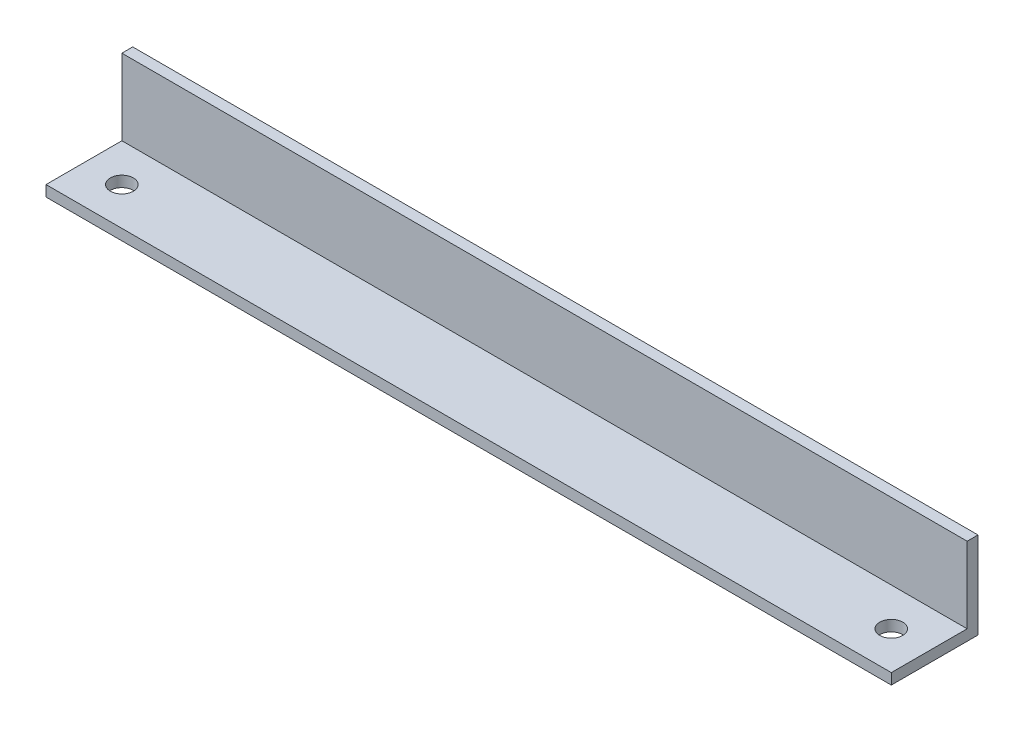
SolidWorks part; units mm, degrees
ref_plane "Front Plane" through (0, 0, 0) normal (0, 0, 1) x (1, 0, 0)
ref_plane "Top Plane" through (0, 0, 0) normal (0, 1, 0) x (1, 0, 0)
ref_plane "Right Plane" through (0, 0, 0) normal (1, 0, 0) x (0, 0, -1)
sketch "Sketch1" plane through (0, 0, 0) normal (0, 1, 0) x (1, 0, 0)
  line L1 (-123.825, 12.7) -> (123.825, 12.7)
  line L2 (-123.825, 12.7) -> (-123.825, -12.7)
  line L3 (-123.825, -12.7) -> (123.825, -12.7)
  line L4 (123.825, 12.7) -> (123.825, -12.7)
  line L5 (-123.825, 12.7) -> (123.825, -12.7) construction
  line L6 (-123.825, -12.7) -> (123.825, 12.7) construction
  point P0 (0, 0)
  dimension "D1" = 247.65
  dimension "D2" = 25.4
extrude "Boss-Extrude1" add sketch "Sketch1" along normal blind 3.175
sketch "Sketch2" plane through (0, 3.175, 0) normal (0, 1, 0) x (1, 0, 0)
  line L0 (-123.825, 12.7) -> (-123.825, 9.525)
  line L1 (-123.825, 12.7) -> (-123.825, -12.7) construction
  line L2 (-123.825, 9.525) -> (123.825, 9.525)
  line L3 (123.825, -12.7) -> (123.825, 12.7) construction
  line L4 (123.825, 9.525) -> (123.825, 12.7)
  line L5 (123.825, 12.7) -> (-123.825, 12.7)
  dimension "D1" = 3.175
extrude "Boss-Extrude2" add sketch "Sketch2" along normal blind 22.225
sketch "Sketch3" plane through (0, 3.175, 0) normal (0, 1, 0) x (1, 0, 0)
  line L0 (-123.825, -1.5875) -> (123.825, -1.5875) construction
  line L1 (-123.825, 9.525) -> (-123.825, -12.7) construction
  line L2 (123.825, -12.7) -> (123.825, 9.525) construction
  line L3 (-123.825, -12.7) -> (123.825, -12.7) construction
  circle A0 centre (-112.7125, -1.5875) radius 3.3782
  circle A2 centre (112.7125, -1.5875) radius 3.3782
  dimension "D3" = 6.7564
  dimension "D4" = 6.7564
  dimension "D1" = 11.1125
  dimension "D6" = 11.1125
  dimension "D8" = 11.1125
extrude "Cut-Extrude1" cut sketch "Sketch3" against normal through all
